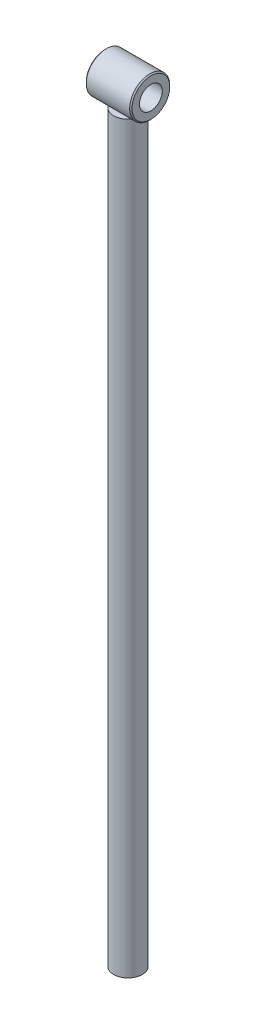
SolidWorks part; units mm, degrees
ref_plane "Plan de face" through (0, 0, 0) normal (0, 0, 1) x (1, 0, 0)
ref_plane "Plan de dessus" through (0, 0, 0) normal (0, 1, 0) x (1, 0, 0)
ref_plane "Plan de droite" through (0, 0, 0) normal (1, 0, 0) x (0, 0, -1)
sketch "Esquisse1" plane through (0, 0, 0) normal (0, 1, 0) x (1, 0, 0)
  circle A0 centre (0, 0) radius 12.5
  dimension "D1" = 25
extrude "Extrusion1" add sketch "Esquisse1" along normal blind 650
sketch "Esquisse2" plane through (0, 0, 0) normal (1, 0, 0) x (0, 0, -1)
  line L0 (12.5, 650) -> (-12.5, 650) construction
  circle A0 centre (0, 667.5) radius 17.5
  circle A1 centre (0, 667.5) radius 10
  dimension "D1" = 35
  dimension "D2" = 20
extrude "Extrusion2" add sketch "Esquisse2" along normal mid plane 40
chamfer "Chanfrein1" distance 1 angle 45 2 edges at (-20, 667.5, -17.5) (20, 667.5, -17.5)
